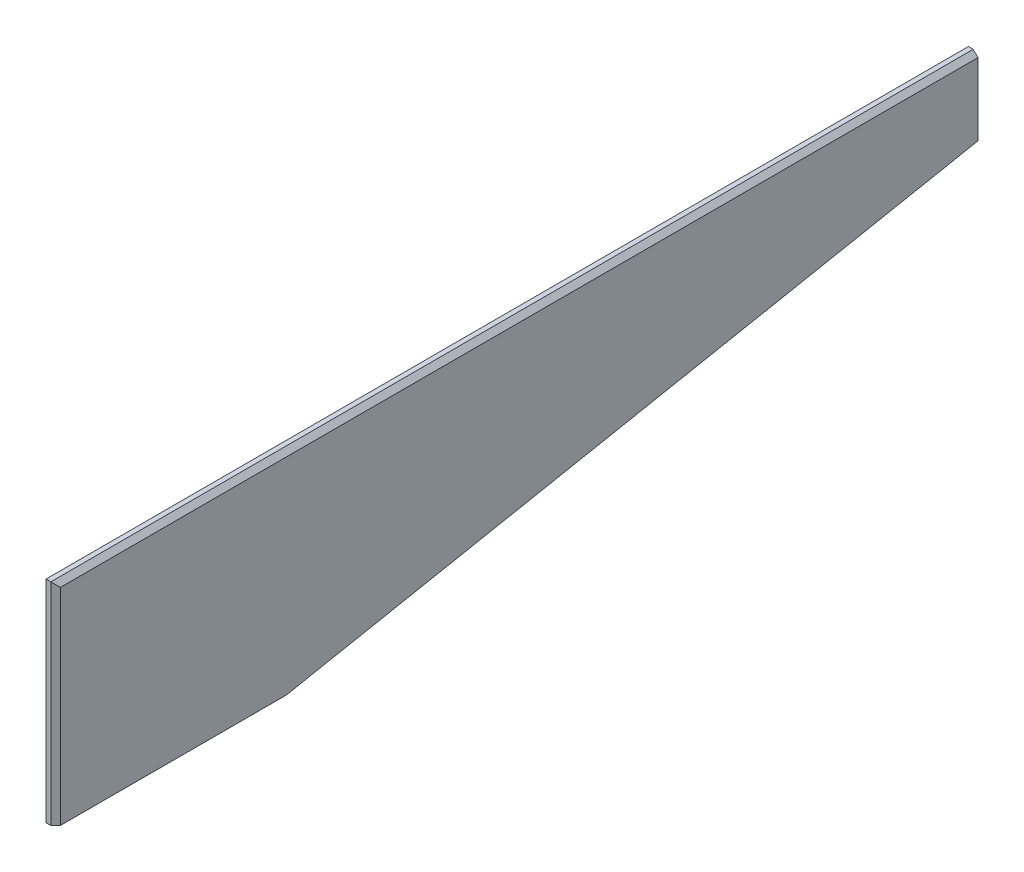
SolidWorks part; units mm, degrees
ref_plane "Front Plane" through (0, 0, 0) normal (1, 0, 0) x (0, 1, 0)
ref_plane "Top Plane" through (0, 0, 0) normal (0, 0, 1) x (0, 1, 0)
ref_plane "Right Plane" through (0, 0, 0) normal (0, 1, 0) x (-1, 0, 0)
sketch "Sketch3" plane through (0, 0, 0) normal (1, 0, 0) x (0, 1, 0)
  point P2 (0, 0)
  line B0 (-63.5, -76.2) -> (63.5, -76.2)
  line B1 (-76.2, -63.5) -> (-76.2, 63.5)
  line B2 (63.5, 76.2) -> (-63.5, 76.2)
  line B3 (76.2, 63.5) -> (76.2, -63.5)
  line B4 (-63.5, 63.5) -> (63.5, -63.5) construction
  line B5 (69.85, 63.5) -> (69.85, -63.5)
  line B6 (-63.5, -69.85) -> (63.5, -69.85)
  line B7 (-69.85, -63.5) -> (-69.85, 63.5)
  line B8 (63.5, 69.85) -> (-63.5, 69.85)
  arc B9 (76.2, 63.5) -> (63.5, 76.2) centre (63.5, 63.5) ccw
  arc B10 (63.5, -76.2) -> (76.2, -63.5) centre (63.5, -63.5) ccw
  arc B11 (-76.2, -63.5) -> (-63.5, -76.2) centre (-63.5, -63.5) ccw
  arc B12 (-63.5, 76.2) -> (-76.2, 63.5) centre (-63.5, 63.5) ccw
  arc B13 (63.5, -69.85) -> (69.85, -63.5) centre (63.5, -63.5) ccw
  arc B14 (-69.85, -63.5) -> (-63.5, -69.85) centre (-63.5, -63.5) ccw
  arc B15 (-63.5, 69.85) -> (-69.85, 63.5) centre (-63.5, 63.5) ccw
  arc B16 (69.85, 63.5) -> (63.5, 69.85) centre (63.5, 63.5) ccw
sketch_block_instance "6in beam-1"
sketch_block "6in beam" parameters "D1"=12.7, "D2"=152.4, "D3"=152.4
sketch "Sketch6" plane through (0, 0, 0) normal (0, 0, 1) x (0, 1, 0)
  point P0 (0, 0)
  line B0 (-63.5, -76.2) -> (63.5, -76.2)
  line B1 (-76.2, -63.5) -> (-76.2, 63.5)
  line B2 (63.5, 76.2) -> (-63.5, 76.2)
  line B3 (76.2, 63.5) -> (76.2, -63.5)
  line B4 (-63.5, 63.5) -> (63.5, -63.5) construction
  line B5 (69.85, 63.5) -> (69.85, -63.5)
  line B6 (-63.5, -69.85) -> (63.5, -69.85)
  line B7 (-69.85, -63.5) -> (-69.85, 63.5)
  line B8 (63.5, 69.85) -> (-63.5, 69.85)
  arc B9 (76.2, 63.5) -> (63.5, 76.2) centre (63.5, 63.5) ccw
  arc B10 (63.5, -76.2) -> (76.2, -63.5) centre (63.5, -63.5) ccw
  arc B11 (-76.2, -63.5) -> (-63.5, -76.2) centre (-63.5, -63.5) ccw
  arc B12 (-63.5, 76.2) -> (-76.2, 63.5) centre (-63.5, 63.5) ccw
  arc B13 (63.5, -69.85) -> (69.85, -63.5) centre (63.5, -63.5) ccw
  arc B14 (-69.85, -63.5) -> (-63.5, -69.85) centre (-63.5, -63.5) ccw
  arc B15 (-63.5, 69.85) -> (-69.85, 63.5) centre (-63.5, 63.5) ccw
  arc B16 (69.85, 63.5) -> (63.5, 69.85) centre (63.5, 63.5) ccw
sketch_block_instance "6in beam-2"
ref_plane "Plane2" through (-69.723, 0, 0) normal (1, 0, 0) x (0, 1, 0)
ref_plane "Plane1" through (69.723, 0, 0) normal (1, 0, 0) x (0, 1, 0)
sketch "Sketch4" plane through (0, 0, 0) normal (1, 0, 0) x (0, 1, 0)
  line L18 (-69.723, -63.5) -> (-69.723, 63.5)
  line L19 (-69.723, -63.5) -> (-69.723, 63.5)
  line L32 (63.5, 69.723) -> (-63.5, 69.723)
  line L33 (63.5, 69.723) -> (-63.5, 69.723)
  line L35 (69.723, 63.5) -> (69.723, -63.5)
  line L36 (69.723, 63.5) -> (69.723, -63.5)
  line L37 (-69.723, -63.5) -> (-63.5, -69.723)
  line L38 (-63.5, -69.723) -> (63.5, -69.723)
  line L39 (-63.5, -69.723) -> (63.5, -69.723)
  line L40 (69.723, -63.5) -> (63.5, -69.723)
  line L41 (63.5, 69.723) -> (69.723, 63.5)
  line L42 (-63.5, 69.723) -> (-69.723, 63.5)
  dimension "D1" = 0.127
  dimension "D2" = 0.127
  dimension "D3" = 0.127
  dimension "D4" = 0.127
extrude "Boss-Extrude1" [suppressed] add sketch "Sketch4" along normal mid plane 1.5875
sketch "Sketch5" plane through (0, 0, 0) normal (1, 0, 0) x (0, 1, 0)
  line L0 (69.723, -256.5882) -> (69.723, -713.7882)
  line L1 (69.723, -713.7882) -> (18.923, -713.7882)
  line L6 (18.923, -713.7882) -> (-69.723, -256.5882)
  line L8 (-69.85, -63.5) -> (-69.85, 63.5) construction
  line L9 (-69.723, -104.1882) -> (69.723, -104.1882)
  line L10 (-69.723, -104.1882) -> (-69.723, -256.5882)
  line L11 (-69.723, -256.5882) -> (69.723, -256.5882) construction
  line L12 (69.723, -104.1882) -> (69.723, -256.5882)
  line L13 (69.85, 63.5) -> (69.85, -63.5) construction
  point P6 (-69.723, -180.3882)
  dimension "D3" = 152.4
  dimension "D1" = 0.127
  dimension "D2" = 0.127
  dimension "D4" = 457.2
  dimension "D5" = 50.8
extrude "Boss-Extrude4" add sketch "Sketch5" along normal mid plane 9.525
sketch "Sketch7" [suppressed] plane through (0, 0, 0) normal (1, 0, 0) x (0, 1, 0)
  line L0 (-127, -34.6135) -> (76.2, -34.6135)
  line L1 (76.2, -34.6135) -> (76.2, -339.4135)
  line L2 (76.2, -339.4135) -> (38.1, -339.4135)
  line L3 (38.1, -339.4135) -> (-127, -72.7135)
  line L4 (-127, -72.7135) -> (-127, -34.6135)
  line L5 (76.2, 63.5) -> (76.2, -63.5) construction
  line L6 (-76.2, -63.5) -> (-76.2, 63.5) construction
  dimension "D1" = 50.8
  dimension "D2" = 304.8
  dimension "D3" = 38.1
  dimension "D4" = 38.1
extrude "Boss-Extrude5" [suppressed] add sketch "Sketch7" along normal mid plane 12.7
sketch "Sketch8" [suppressed] plane through (0, 0, 0) normal (0, 0, 1) x (0, 1, 0)
  line L1 (-130.175, 63.5) -> (130.175, 63.5)
  line L2 (-130.175, 63.5) -> (-130.175, -63.5)
  line L3 (-130.175, -63.5) -> (130.175, -63.5)
  line L4 (130.175, 63.5) -> (130.175, -63.5)
  line L5 (-130.175, 63.5) -> (130.175, -63.5) construction
  line L6 (-130.175, -63.5) -> (130.175, 63.5) construction
  point P0 (0, 0)
  dimension "D1" = 127
  dimension "D2" = 260.35
extrude "Boss-Extrude6" [suppressed] add sketch "Sketch8" along normal mid plane 9.525
chamfer "Chamfer1" [suppressed] distance 5 angle 75
fillet "Fillet1" [suppressed] radius 12.7
chamfer "Chamfer2" [suppressed] distance 3.175 angle 45
chamfer "Chamfer3" distance 3.175 angle 45 4 edges at (-4.7625, 69.723, -408.9882) (-4.7625, 0, -104.1882) (4.7625, 0, -104.1882) (4.7625, 69.723, -408.9882)
sketch "Sketch9" [suppressed] plane through (0, 0, 0) normal (0, 0, 1) x (0, 1, 0)
  line L1 (-63.5, 25.4) -> (63.5, 25.4)
  line L2 (-63.5, 25.4) -> (-63.5, -25.4)
  line L3 (-63.5, -25.4) -> (63.5, -25.4)
  line L4 (63.5, 25.4) -> (63.5, -25.4)
  line L5 (-63.5, 25.4) -> (63.5, -25.4) construction
  line L6 (-63.5, -25.4) -> (63.5, 25.4) construction
  point P0 (0, 0)
  dimension "D1" = 50.8
  dimension "D2" = 127
extrude "Boss-Extrude7" [suppressed] add sketch "Sketch9" along normal mid plane 6.35
sketch "Sketch10" [suppressed] plane through (0, 0, 0) normal (0, 0, 1) x (0, 1, 0)
  line L1 (-38.1, 101.6) -> (38.1, 101.6)
  line L2 (-38.1, 101.6) -> (-38.1, -101.6)
  line L3 (-38.1, -101.6) -> (38.1, -101.6)
  line L4 (38.1, 101.6) -> (38.1, -101.6)
  line L5 (-38.1, 101.6) -> (38.1, -101.6) construction
  line L6 (-38.1, -101.6) -> (38.1, 101.6) construction
  point P0 (0, 0)
  dimension "D1" = 76.2
  dimension "D2" = 203.2
extrude "Boss-Extrude8" [suppressed] add sketch "Sketch10" along normal mid plane 9.525
chamfer "Chamfer4" [suppressed] distance 3.175 angle 45
